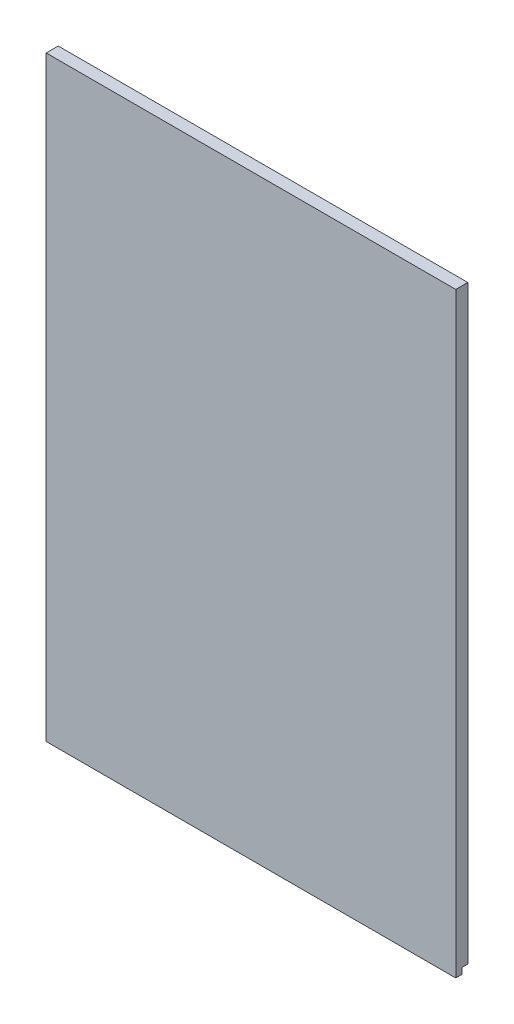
SolidWorks part; units mm, degrees
ref_plane "Ebene vorne" through (0, 0, 0) normal (0, 0, 1) x (1, 0, 0)
ref_plane "Ebene oben" through (0, 0, 0) normal (0, 1, 0) x (1, 0, 0)
ref_plane "Ebene rechts" through (0, 0, 0) normal (1, 0, 0) x (0, 0, -1)
sketch "Skizze1" plane through (0, 0, 0) normal (0, 0, 1) x (1, 0, 0)
  line L1 (0, 0) -> (68, 0)
  line L2 (0, 0) -> (0, 98)
  line L3 (0, 98) -> (68, 98)
  line L4 (68, 0) -> (68, 98)
  dimension "D1" = 98
  dimension "D2" = 68
extrude "Aufsatz-Linear austragen1" add sketch "Skizze1" along normal blind 2
sketch "Skizze2" plane through (0, 0, 0) normal (0, 0, -1) x (-1, 0, 0)
  line L0 (0, 98) -> (0, 0) construction
  line L1 (-4, 96) -> (-2, 96)
  line L2 (-4, 96) -> (-4, 94)
  line L3 (-4, 94) -> (-2, 94)
  line L4 (-2, 96) -> (-2, 94)
  line L5 (-68, 98) -> (0, 98) construction
  line L6 (0, 49) -> (-68, 49) construction
  line L7 (-68, 0) -> (-68, 98) construction
  line L8 (-4, 4) -> (-2, 4)
  line L9 (-2, 2) -> (-2, 4)
  line L10 (-4, 2) -> (-2, 2)
  line L11 (-4, 2) -> (-4, 4)
  line L12 (-34, 98) -> (-34, 0) construction
  line L13 (0, 0) -> (-68, 0) construction
  line L14 (-64, 94) -> (-66, 94)
  line L15 (-66, 96) -> (-66, 94)
  line L16 (-64, 96) -> (-66, 96)
  line L17 (-64, 96) -> (-64, 94)
  line L18 (-30, 0) -> (-30, 49) construction
  line L19 (-56, 2) -> (-56, 4)
  line L20 (-56, 2) -> (-58, 2)
  line L21 (-58, 2) -> (-58, 4)
  line L22 (-56, 4) -> (-58, 4)
  dimension "D1" = 2
  dimension "D2" = 2
  dimension "D3" = 2
  dimension "D4" = 2
  dimension "D5" = 30
extrude "Schnitt-Linear austragen1" cut sketch "Skizze2" against normal blind 1
fillet "Verrundung2" radius 0.2 47 edges at (66, 94, 0.5) (66, 95, 1) (65, 96, 1) (65, 94, 1) (64, 95, 1) (64, 94, 0.5) (66, 96, 0.5) (65, 96, 0) (64, 96, 0.5) (65, 94, 0) (66, 95, 0) (64, 95, 0) (4, 94, 0.5) (3, 94, 1) (2, 95, 1) (2, 94, 0.5) (3, 94, 0) (4, 95, 0) (4, 95, 1) (4, 96, 0.5) (3, 96, 1) (2, 96, 0.5) (2, 95, 0) (3, 96, 0) (4, 2, 0.5) (3, 2, 1) (2, 3, 1) (2, 2, 0.5) (3, 2, 0) (4, 3, 0) (4, 3, 1) (4, 4, 0.5) (3, 4, 1) (2, 4, 0.5) (3, 4, 0) (2, 3, 0) (58, 3, 1) (58, 2, 0.5) (57, 2, 1) (58, 4, 0.5) (57, 4, 1) (56, 2, 0.5) (56, 3, 1) (57, 2, 0) (58, 3, 0) (57, 4, 0) (56, 3, 0)
sketch "Skizze3" plane through (0, 0, 0) normal (0, -1, 0) x (1, 0, 0)
  line L0 (68, 2) -> (68, 0) construction
  line L1 (0, 2) -> (68, 2)
  line L2 (0, 2) -> (0, 1)
  line L3 (0, 1) -> (68, 1)
  line L4 (68, 2) -> (68, 1)
  dimension "D1" = 1
extrude "Aufsatz-Linear austragen2" add sketch "Skizze3" along normal blind 1
